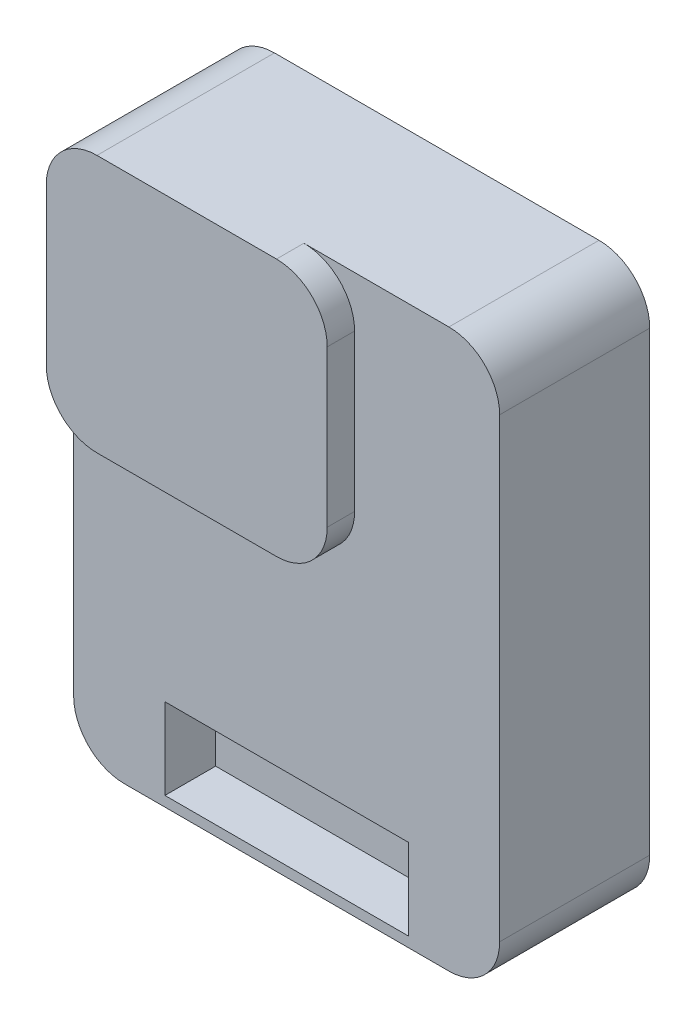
SolidWorks part; units mm, degrees
ref_plane "前视基准面" through (0, 0, 0) normal (0, 0, 1) x (1, 0, 0)
ref_plane "上视基准面" through (0, 0, 0) normal (0, 1, 0) x (1, 0, 0)
ref_plane "右视基准面" through (0, 0, 0) normal (1, 0, 0) x (0, 0, -1)
other "Configuration Table"
sketch "草图1" plane through (0, 0, 0) normal (0, 0, 1) x (1, 0, 0)
  line L1 (-21, 27.5) -> (21, 27.5)
  line L2 (-21, 27.5) -> (-21, -27.5)
  line L3 (-21, -27.5) -> (21, -27.5)
  line L4 (21, 27.5) -> (21, -27.5)
  line L5 (-21, 27.5) -> (21, -27.5) construction
  line L6 (-21, -27.5) -> (21, 27.5) construction
  point P0 (0, 0)
  dimension "D1" = 42
  dimension "D2" = 55
extrude "凸台-拉伸1" add sketch "草图1" along normal blind 14.8
sketch "草图2" plane through (0, 0, 0) normal (0, 0, 1) x (1, 0, 0)
  line L1 (-21, 27.5) -> (6.7, 27.5)
  line L2 (-21, 27.5) -> (-21, 2.1)
  line L3 (-21, 2.1) -> (6.7, 2.1)
  line L4 (6.7, 27.5) -> (6.7, 2.1)
  dimension "D1" = 27.7
  dimension "D2" = 25.4
extrude "凸台-拉伸2" add sketch "草图2" along normal blind 17.5
fillet "圆角1" radius 5 7 edges at (-21, 2.1, 16.15) (6.7, 2.1, 16.15) (6.7, 27.5, 16.15) (21, 27.5, 7.4) (21, -27.5, 7.4) (-21, -27.5, 7.4) (-21, 27.5, 8.75)
sketch "草图3" plane through (0, 0, 14.8) normal (0, 0, 1) x (1, 0, 0)
  line L0 (-21, 7.1) -> (-21, -22.5) construction
  line L1 (-12, -18.5) -> (12, -18.5)
  line L2 (-12, -18.5) -> (-12, -26.5)
  line L3 (-12, -26.5) -> (12, -26.5)
  line L4 (12, -18.5) -> (12, -26.5)
  line L5 (-12, -18.5) -> (12, -26.5) construction
  line L6 (-12, -26.5) -> (12, -18.5) construction
  line L7 (21, -22.5) -> (21, 22.5) construction
  line L8 (-16, -27.5) -> (16, -27.5) construction
  point P0 (0, -22.5)
  dimension "D1" = 9
  dimension "D2" = 9
  dimension "D3" = 8
  dimension "D4" = 1
extrude "切除-拉伸1" cut sketch "草图3" against normal blind 5
